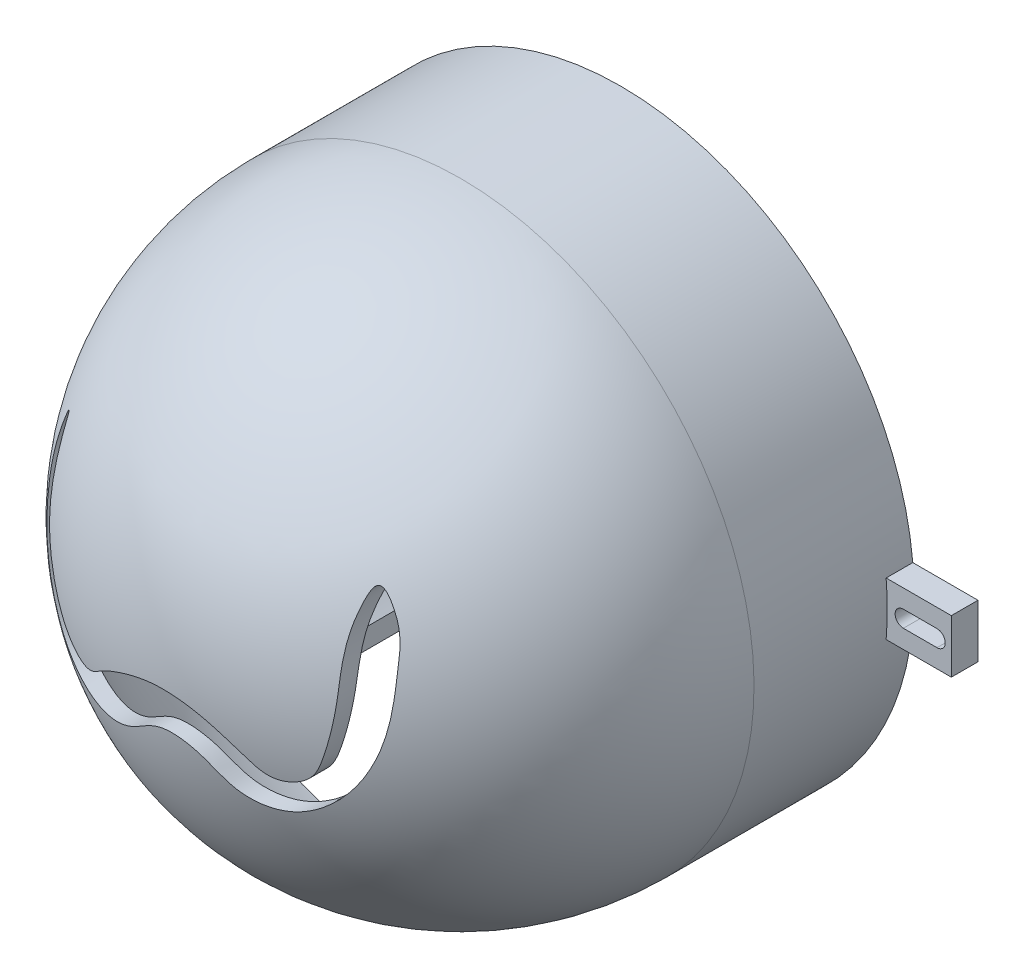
SolidWorks part; units mm, degrees
ref_plane "Front Plane" through (0, 0, 0) normal (0, 0, 1) x (1, 0, 0)
ref_plane "Top Plane" through (0, 0, 0) normal (0, 1, 0) x (1, 0, 0)
ref_plane "Right Plane" through (0, 0, 0) normal (1, 0, 0) x (0, 0, -1)
sketch "Sketch2" plane through (0, 0, 0) normal (1, 0, 0) x (0, 0, -1)
  line L7 (65.5803, 0) -> (147.5803, 0)
  line L8 (147.5803, 0) -> (147.5803, 52)
  line L9 (147.5803, 52) -> (117.5803, 52)
  line L10 (117.5803, 52) -> (117.5803, 0) construction
  line L11 (65.5803, 0) -> (46.7658, 0) construction
  arc A1 (117.5803, 52) -> (65.5803, 0) centre (117.5803, 0) ccw
  dimension "D4" = 52
  dimension "D3" = 30
revolve "Revolve1" add sketch "Sketch2" angle 360 about L11
shell "Shell1" thickness 3
sketch "Sketch5" plane through (0, 0, 0) normal (0, 1, 0) x (1, 0, 0)
  line L0 (-55, 147.5803) -> (55, 147.5803) construction
  line L1 (55, 147.5803) -> (-55, 147.5803) construction
  line L2 (0, 147.5803) -> (0, 100.0199) construction
  line L4 (-32, 147.5803) -> (32, 147.5803)
  line L5 (-32, 147.5803) -> (-32, 106.5803)
  line L6 (-32, 106.5803) -> (32, 106.5803)
  line L7 (32, 147.5803) -> (32, 106.5803)
  point P12 (0, 147.5803)
  dimension "D1" = 64
  dimension "D2" = 41
extrude "Cut-Extrude2" cut sketch "Sketch5" against normal through all
ref_plane "Plane1" through (0, 0, -67.5803) normal (0, 0, -1) x (-1, 0, 0)
sketch "Sketch6" plane through (0, 0, -67.5803) normal (0, 0, -1) x (-1, 0, 0)
  line L0 (-228.021, 103.0378) -> (28.6456, 103.0378) construction
  spline S0 degree 3 poles (38.3471, 11.2509) (35.0848, 22.9055) (35.9096, 5.5718) (31.5895, -1.502) (25.9695, -8.3833) (18.7391, -9.3823) (14.7522, -5.8381) (9.7363, -2.9172) (3.2802, -0.5319) (-5.0447, -1.072) (-11.3051, -4.593) (-16.5079, -9.0906) (-22.1404, -7.1939) (-24.3491, -1.0805) (-25.8221, 8.4528) (-24.4951, 15.7489) (-26.4408, 24.8164) (-30.8169, 18.7026) (-31.5122, 13.3967) (-31.9756, 5.2105) (-30.0828, -2.5083) (-25.5142, -9.9514) (-18.1962, -14.9627) (-9.9902, -13.2705) (-5.595, -8.302) (2.2717, -6.7216) (8.0788, -12.0522) (15.5862, -14.9973) (22.7873, -14.4911) (29.1823, -11.5958) (32.7754, -6.7649) (35.9777, -1.1731) (37.4709, 5.4549) (38.3471, 11.2509) (35.0848, 22.9055) (35.9096, 5.5718) knots -0.084591 -0.055 -0.0249 0 0.047543 0.086529 0.127343 0.150207 0.169698 0.191841 0.224466 0.255222 0.294003 0.315121 0.337438 0.355619 0.394721 0.455796 0.466209 0.484862 0.513641 0.548093 0.583361 0.613542 0.658237 0.684747 0.711698 0.740677 0.774665 0.805471 0.841451 0.862828 0.892573 0.915409 0.945 0.9751 1 1.047543 1.086529 1.127343 only from (36.1408, 18.0279) to (36.1408, 18.0279)
extrude "Cut-Extrude3" cut sketch "Sketch6" against normal through all both and the other way through all
ref_plane "Plane2" through (0, 0, -147.5803) normal (0, 0, -1) x (-1, 0, 0)
ref_plane "Plane3" through (0, 0, -147.5803) normal (0, 0, -1) x (-1, 0, 0)
sketch "Sketch7" plane through (0, 0, -147.5803) normal (0, 0, -1) x (-1, 0, 0)
  line L1 (-67, 0) -> (-67, 5)
  line L2 (-67, 0) -> (-67, -5)
  line L3 (-67, 5) -> (-51.7591, 5)
  line L4 (-51.7591, 5) -> (-52, 0)
  line L5 (-51.7591, -5) -> (-67, -5)
  line L7 (-51.7591, -5) -> (-52, 0)
  line L8 (51.7591, -5) -> (67, -5)
  line L9 (67, 0) -> (67, -5)
  line L10 (67, 0) -> (67, 5)
  line L11 (67, 5) -> (51.7591, 5)
  line L12 (51.7591, 5) -> (52, 0)
  line L13 (51.7591, -5) -> (52, 0)
  arc A0 (32, -40.9878) -> (-32, -40.9878) centre (0, 0) ccw construction
  arc A1 (32, -40.9878) -> (-32, -40.9878) centre (0, 0) ccw construction
  dimension "D1" = 15
  dimension "D2" = 5
  dimension "D3" = 5
extrude "Boss-Extrude1" add sketch "Sketch7" against normal blind 5
sketch "Sketch8" plane through (0, 0, -147.5803) normal (0, 0, -1) x (-1, 0, 0)
  line L0 (-64.3096, 0) -> (-58.0068, 0) construction
  line L1 (-64.3096, 1.55) -> (-58.0068, 1.55)
  line L2 (-64.3096, -1.55) -> (-58.0068, -1.55)
  line L4 (64.3096, 0) -> (58.0068, 0) construction
  line L5 (64.3096, 1.55) -> (58.0068, 1.55)
  line L6 (64.3096, -1.55) -> (58.0068, -1.55)
  arc A0 (-64.3096, 1.55) -> (-64.3096, -1.55) centre (-64.3096, 0) ccw
  arc A1 (-58.0068, -1.55) -> (-58.0068, 1.55) centre (-58.0068, 0) ccw
  arc A2 (64.3096, 1.55) -> (64.3096, -1.55) centre (64.3096, 0) cw
  arc A3 (58.0068, -1.55) -> (58.0068, 1.55) centre (58.0068, 0) cw
  point P3 (-61.1582, 0)
  point P10 (61.1582, 0)
  dimension "D1" = 1.55
extrude "Cut-Extrude4" cut sketch "Sketch8" against normal blind 5
